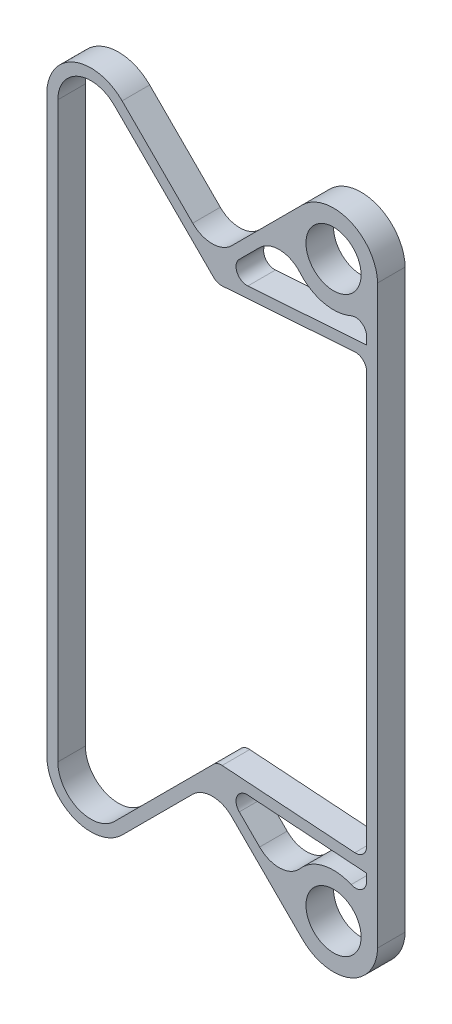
SolidWorks part; units mm, degrees
ref_plane "Plan de face" through (0, 0, 0) normal (0, 0, 1) x (1, 0, 0)
ref_plane "Plan de dessus" through (0, 0, 0) normal (0, 1, 0) x (1, 0, 0)
ref_plane "Plan de droite" through (0, 0, 0) normal (1, 0, 0) x (0, 0, -1)
sketch "Esquisse1" plane through (0, 0, 0) normal (0, 0, 1) x (1, 0, 0)
  line L1 (299.9672, 0) -> (299.9672, 522.2904)
  line L3 (-300, 520) -> (-300, 0)
  line L4 (35.3553, 448.4924) -> (163.4315, 576.5685)
  line L5 (-163.4315, 576.5685) -> (-35.3553, 448.4924)
  line L6 (0, 0) -> (0, 745.5661) construction
  line L7 (49.0707, 433.9235) -> (85.9221, 470.7749)
  line L8 (-177.5736, 562.4264) -> (2.501, 382.3518)
  line L9 (-177.5736, 562.4264) -> (-49.4975, 434.3503) construction
  line L10 (279.9672, 0) -> (279.9672, 373.3217)
  line L11 (-280, 520) -> (-280, 0)
  line L12 (279.9672, 414.8094) -> (64.6006, 399.8296)
  line L14 (-220, 520) -> (220, 520) construction
  line L15 (49.4975, 434.3503) -> (177.5736, 562.4264) construction
  line L16 (258.5795, 393.2735) -> (18.0309, 376.5421)
  line L17 (279.9672, -500.5004) -> (279.9672, 522.2904) construction
  line L18 (279.9672, 414.8094) -> (279.9672, 428.3342)
  line L20 (279.9672, 414.8094) -> (-9.8017, 394.6546) construction
  line L21 (281.355, 394.8576) -> (-8.414, 374.7028) construction
  line L22 (418.8306, 0) -> (-729.0086, 0) construction
  line L23 (-280, 0) -> (-300, 0)
  line L24 (299.9672, -500.5004) -> (299.9672, 522.2904) construction
  line L25 (279.9672, 0) -> (299.9672, 0)
  line L26 (-220, 600) -> (407.2449, 600) construction
  arc A2 (299.9672, 522.2904) -> (220, 600) centre (220, 520) ccw
  arc A3 (-220, 600) -> (-300, 520) centre (-220, 520) ccw
  circle A4 centre (220, 520) radius 50
  arc A6 (299.9672, 517.7096) -> (163.4315, 576.5685) centre (220, 520) ccw
  arc A7 (-163.4315, 576.5685) -> (-300, 520) centre (-220, 520) ccw
  arc A8 (35.3553, 448.4924) -> (-35.3553, 448.4924) centre (0, 483.8478) cw
  arc A9 (140.157, 525.0098) -> (140, 520) centre (220, 520) ccw
  arc A10 (-177.5736, 562.4264) -> (-280, 520) centre (-220, 520) ccw
  arc A11 (140.157, 525.0098) -> (140, 520) centre (220, 520) ccw
  arc A12 (299.9672, 517.7096) -> (163.4315, 576.5685) centre (220, 520) ccw
  arc A13 (159.2476, 467.9505) -> (225.551, 440.1928) centre (220, 520) ccw
  arc A14 (299.9672, 517.7096) -> (163.4315, 576.5685) centre (220, 520) ccw
  arc A15 (159.2476, 467.9505) -> (251.9738, 446.6673) centre (220, 520) ccw
  arc A16 (159.2476, 467.9505) -> (85.9221, 470.7749) centre (121.2774, 435.4196) ccw
  arc A17 (64.6006, 399.8296) -> (49.0707, 433.9235) centre (63.2129, 419.7814) cw
  arc A18 (279.9672, 428.3342) -> (251.9738, 446.6673) centre (259.9672, 428.3342) ccw
  arc A19 (279.9672, 373.3217) -> (258.5795, 393.2735) centre (259.9672, 373.3217) ccw
  arc A20 (2.501, 382.3518) -> (18.0309, 376.5421) centre (16.6432, 396.4939) ccw
  point P21 (77.9713, 392.1134)
  point P43 (175.5124, 489.6545)
  dimension "D1" = 100
  dimension "D3" = 50
  dimension "D2" = 20
  dimension "D11" = 50
  dimension "D4" = 20
  dimension "D12" = 20
  dimension "D13" = 20
  dimension "D8" = 520
  dimension "D9" = 220
  dimension "D5" = 20
  dimension "D6" = 20
  dimension "D7" = 20
  dimension "D10" = 20
extrude "Boss.-Extru.1" add sketch "Esquisse1" along normal blind 50
mirror "Symétrie1" about plane through (0, 0, 0) normal (0, 1, 0)
